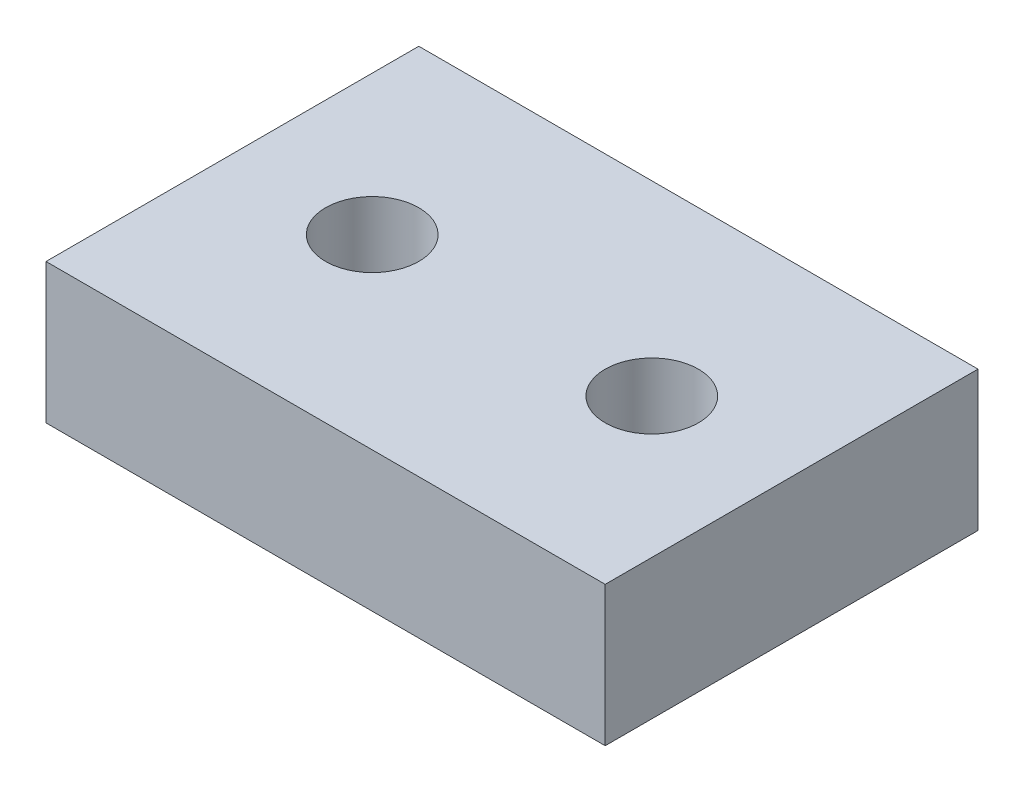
SolidWorks part; units mm, degrees
ref_plane "front" through (0, 0, 0) normal (0, 0, 1) x (1, 0, 0)
ref_plane "top" through (0, 0, 0) normal (0, 1, 0) x (1, 0, 0)
ref_plane "side" through (0, 0, 0) normal (1, 0, 0) x (0, 0, -1)
sketch "Sketch1" plane through (0, 0, 0) normal (0, 0, 1) x (1, 0, 0)
  line L0 (0, 0) -> (76.2, 0)
  line L1 (0, 0) -> (0, 19.05)
  line L2 (76.2, 19.05) -> (0, 19.05)
  line L3 (76.2, 19.05) -> (76.2, 0)
  dimension "D1" = 76.2
  dimension "D2" = 19.05
extrude "Base-Extrude" add sketch "Sketch1" along normal blind 50.8
sketch "Sketch2" plane through (0, 19.05, 0) normal (0, 1, 0) x (-1, 0, 0)
  line L0 (-76.2, 25.4) -> (0, 25.4) construction
  line L3 (-76.2, 50.8) -> (-76.2, 0) construction
  line L4 (0, 50.8) -> (0, 0) construction
  circle A0 centre (-57.15, 25.4) radius 6.35
  circle A2 centre (-19.05, 25.4) radius 6.35
  dimension "D1" = 12.7
  dimension "D2" = 19.05
  dimension "D3" = 19.05
extrude "Cut-Extrude1" cut sketch "Sketch2" against normal through all
